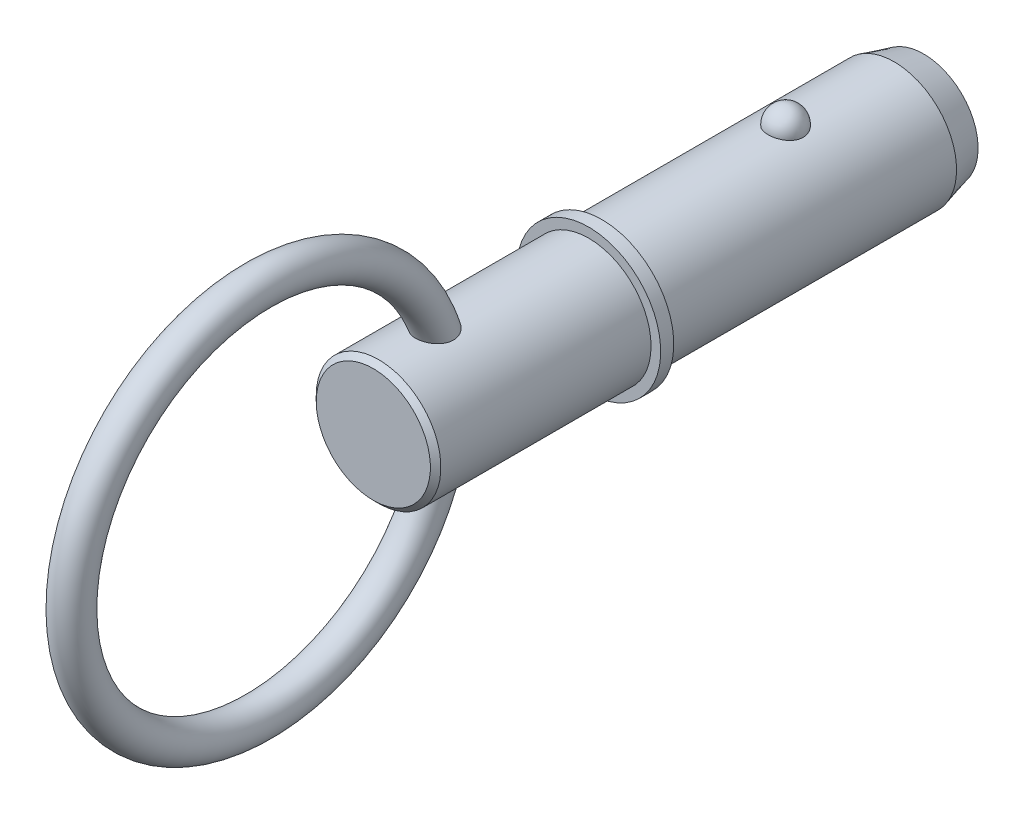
SolidWorks part; units mm, degrees
ref_plane "Front Plane" through (0, 0, 0) normal (0, 0, 1) x (1, 0, 0)
ref_plane "Top Plane" through (0, 0, 0) normal (0, 1, 0) x (1, 0, 0)
ref_plane "Right Plane" through (0, 0, 0) normal (1, 0, 0) x (0, 0, -1)
sketch "Sketch2" plane through (0, 0, 0) normal (0, 0, 1) x (1, 0, 0)
  circle A0 centre (0, 0) radius 9.525
  point P3 (0, 9.525)
  dimension "D1" = 19.05
extrude "Boss-Extrude1" add sketch "Sketch2" along normal blind 25.4
sketch "Sketch3" plane through (0, 0, 0) normal (0, 0, -1) x (-1, 0, 0)
  circle A0 centre (0, 0) radius 9.525
  dimension "D1" = 19.05
extrude "Boss-Extrude2" add sketch "Sketch3" along normal blind 23.8
chamfer "Chamfer1" distance 4.5 angle 15 1 edges at (-9.525, 0, -23.8)
sketch "Sketch18" plane through (0, 0, 0) normal (1, 0, 0) x (0, 0, -1)
  line L0 (19.3, 9.525) -> (-25.4, 9.525) construction
  line L1 (2.69, 12.215) -> (2.69, 6.835)
  line L2 (-25.4, -9.525) -> (19.3, -9.525) construction
  arc A0 (2.69, 12.215) -> (2.69, 6.835) centre (2.69, 9.525) ccw
  point P4 (0, 9.525)
  dimension "D1" = 21.74
revolve "Revolve1" add sketch "Sketch18" angle 360 about L1
sketch "Sketch19" plane through (0, 0, 0) normal (1, 0, 0) x (0, 0, -1)
  line L0 (-33.7288, 0) -> (-46.4542, 0) construction
sketch "Sketch20" plane through (0, 0, 0) normal (1, 0, 0) x (0, 0, -1)
  line L0 (-25.4, 0) -> (-25.4, 11)
  line L1 (-25.4, 9.525) -> (-25.4, -9.525) construction
  line L2 (-25.4, 11) -> (-27.4, 11)
  line L3 (-27.4, 11) -> (-27.4, 0)
  line L4 (-33.7288, 0) -> (-46.4542, 0) construction
  line L5 (-27.4, 0) -> (-25.4, 0)
  dimension "D1" = 11
  dimension "D2" = 2
revolve "Revolve2" add sketch "Sketch20" angle 360 about L0
sketch "Sketch21" plane through (0, 0, 25.4) normal (0, 0, -1) x (-1, 0, 0)
  circle A0 centre (0, 0) radius 9.525
  dimension "D1" = 19.05
extrude "Boss-Extrude3" add sketch "Sketch21" against normal blind 34.93
chamfer "Chamfer2" distance 0.8 angle 45 1 edges at (-9.525, 0, 60.33)
sketch "Sketch23" plane through (0, 0, 0) normal (1, 0, 0) x (0, 0, -1)
  line L0 (-60.33, 8.725) -> (-60.33, -8.725) construction
  circle A0 centre (-77.905, 0) radius 28.575
  point P2 (-49.33, 0)
  dimension "D1" = 57.15
  dimension "D2" = 11
sketch "Sketch24" plane through (0, 0, 0) normal (0, 1, 0) x (1, 0, 0)
  circle A0 centre (0, -49.33) radius 2.75
  dimension "D1" = 5.5
sweep "Sweep1" add profiles "Sketch24" path "Sketch23"
